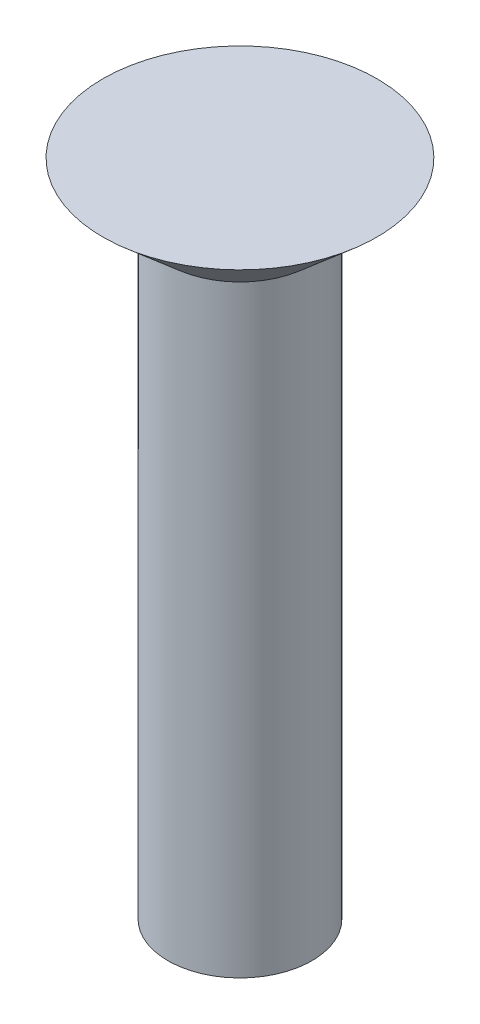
SolidWorks part; units mm, degrees
ref_plane "Front Plane" through (0, 0, 0) normal (0, 0, 1) x (1, 0, 0)
ref_plane "Top Plane" through (0, 0, 0) normal (0, 1, 0) x (1, 0, 0)
ref_plane "Right Plane" through (0, 0, 0) normal (1, 0, 0) x (0, 0, -1)
sketch "Sketch1" plane through (0, 0, 0) normal (0, 0, 1) x (1, 0, 0)
  line L0 (0, 0) -> (0, -19.05) construction
  line L1 (0, 0) -> (3.9624, 0)
  line L2 (3.9624, 0) -> (2.0828, -1.6339)
  line L3 (2.0828, -1.6339) -> (2.0828, -19.05)
  line L4 (2.0828, -19.05) -> (0, -19.05)
  line L5 (0, 0) -> (0, -19.05)
  dimension "D1" = 7.9248
  dimension "D2" = 4.1656
  dimension "D3" = 41
  dimension "D4" = 19.05
revolve "Revolve1" add sketch "Sketch1" angle 360 about L0
